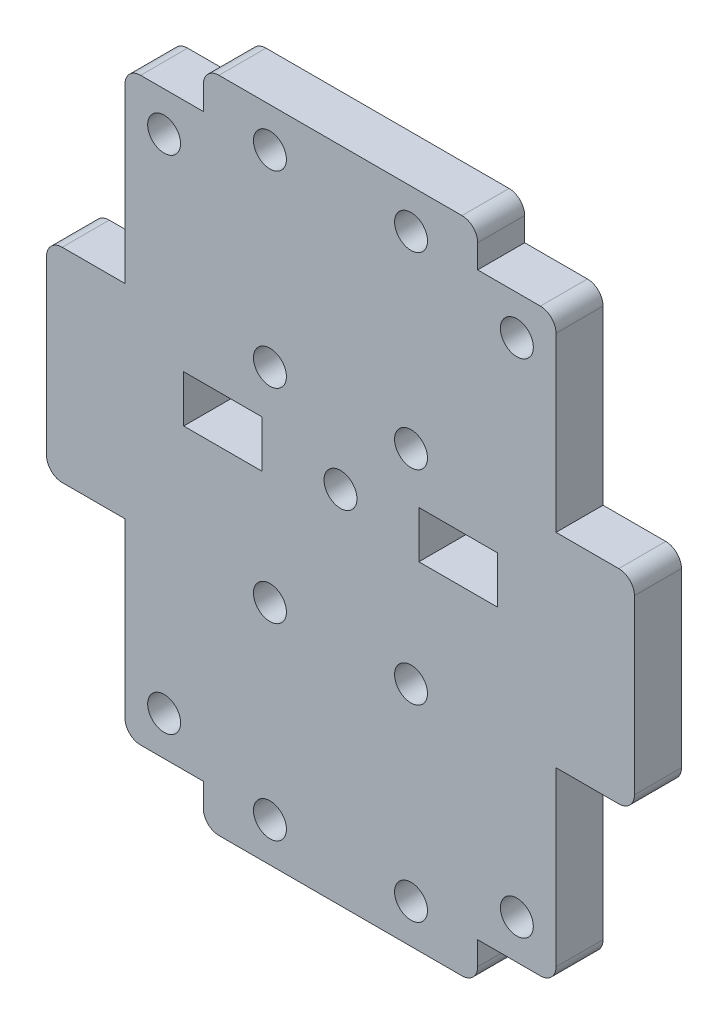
SolidWorks part; units mm, degrees
ref_plane "Спереди" through (0, 0, 0) normal (0, 0, 1) x (1, 0, 0)
ref_plane "Сверху" through (0, 0, 0) normal (0, 1, 0) x (1, 0, 0)
ref_plane "Справа" through (0, 0, 0) normal (1, 0, 0) x (0, 0, -1)
sketch "Эскиз1" plane through (0, 0, 0) normal (0, 0, 1) x (1, 0, 0)
  line L0 (0, 42) -> (17.5, 42) construction
  line L1 (2, 0) -> (33, 0)
  line L2 (0, 2) -> (0, 82)
  line L3 (2, 84) -> (33, 84)
  line L4 (35, 2) -> (35, 82)
  line L5 (8.5, 29) -> (26.5, 29) construction
  line L6 (8.5, 29) -> (8.5, 5) construction
  line L7 (8.5, 5) -> (26.5, 5) construction
  line L8 (26.5, 29) -> (26.5, 5) construction
  line L9 (26.5, 55) -> (26.5, 79) construction
  line L10 (8.5, 79) -> (26.5, 79) construction
  line L11 (8.5, 55) -> (8.5, 79) construction
  line L12 (8.5, 55) -> (26.5, 55) construction
  line L13 (17.5, 84) -> (17.5, 80.8453) construction
  line L14 (-2.5, 49) -> (7.5, 49)
  line L15 (-2.5, 49) -> (-2.5, 43)
  line L16 (-2.5, 43) -> (7.5, 43)
  line L17 (7.5, 49) -> (7.5, 43)
  line L18 (27.5, 49) -> (37.5, 49)
  line L19 (27.5, 49) -> (27.5, 43)
  line L20 (27.5, 43) -> (37.5, 43)
  line L21 (37.5, 49) -> (37.5, 43)
  line L22 (0, 55) -> (-18, 55)
  line L23 (0, 55) -> (0, 29)
  line L24 (0, 29) -> (-18, 29)
  line L25 (-20, 53) -> (-20, 31)
  line L26 (35, 55) -> (53, 55)
  line L27 (35, 29) -> (53, 29)
  line L28 (55, 53) -> (55, 31)
  circle A0 centre (8.5, 29) radius 2.1
  circle A1 centre (26.5, 29) radius 2.1
  circle A2 centre (26.5, 5) radius 2.1
  circle A3 centre (8.5, 5) radius 2.1
  circle A4 centre (8.5, 79) radius 2.1
  circle A5 centre (26.5, 79) radius 2.1
  circle A6 centre (26.5, 55) radius 2.1
  circle A7 centre (8.5, 55) radius 2.1
  circle A8 centre (17.5, 46) radius 2.1
  arc A9 (-18, 29) -> (-20, 31) centre (-18, 31) cw
  arc A10 (-18, 55) -> (-20, 53) centre (-18, 53) ccw
  arc A11 (53, 55) -> (55, 53) centre (53, 53) cw
  arc A12 (53, 29) -> (55, 31) centre (53, 31) ccw
  arc A13 (2, 0) -> (0, 2) centre (2, 2) cw
  arc A14 (33, 0) -> (35, 2) centre (33, 2) ccw
  arc A15 (33, 84) -> (35, 82) centre (33, 82) cw
  arc A16 (0, 82) -> (2, 84) centre (2, 82) cw
  point P13 (17.5, 0)
  point P14 (17.5, 5)
  point P25 (17.5, 79)
  point P26 (8.5, 67)
  point P27 (8.5, 17)
  point P38 (7.5, 46)
  point P39 (27.5, 46)
  point P50 (-20, 55)
  point P59 (55, 55)
  point P62 (0, 0)
  point P65 (35, 0)
extrude "Бобышка-Вытянуть1" add sketch "Эскиз1" along normal blind 6 contours L22 A10 L25 A9 L24 L2 L16 L15 L14 | A16 L2 L14 L17 L16 A13 L1 A14 L4 L20 L19 L18 A15 L3 A8 A6 A4 A3 A2 A1 A0 A5 A7 | L27 A12 L28 A11 L26 L4 L18 L21 L20
sketch "Эскиз2" plane through (0, 0, 6) normal (0, 0, 1) x (1, 0, 0)
  line L0 (0, 55) -> (0, 82) construction
  line L1 (0, 79) -> (-8, 79)
  line L2 (0, 79) -> (0, 53)
  line L3 (0, 53) -> (-8, 53)
  line L4 (-10, 77) -> (-10, 55)
  line L5 (2, 84) -> (33, 84) construction
  line L6 (17.5, 84) -> (17.5, 88.9599) construction
  line L7 (-20, 42) -> (-32.8086, 42) construction
  line L8 (-20, 53) -> (-20, 31) construction
  line L9 (45, 77) -> (45, 55)
  line L10 (35, 53) -> (43, 53)
  line L11 (35, 79) -> (35, 53)
  line L12 (35, 79) -> (43, 79)
  line L13 (17.5, 0) -> (17.5, -4.9599) construction
  line L14 (35, 5) -> (43, 5)
  line L15 (35, 5) -> (35, 31)
  line L16 (35, 31) -> (43, 31)
  line L17 (45, 7) -> (45, 29)
  line L18 (-10, 7) -> (-10, 29)
  line L19 (0, 31) -> (-8, 31)
  line L20 (0, 5) -> (0, 31)
  line L21 (0, 5) -> (-8, 5)
  arc A0 (-8, 53) -> (-10, 55) centre (-8, 55) cw
  arc A1 (-8, 79) -> (-10, 77) centre (-8, 77) ccw
  arc A2 (43, 79) -> (45, 77) centre (43, 77) cw
  arc A3 (43, 53) -> (45, 55) centre (43, 55) ccw
  arc A4 (43, 31) -> (45, 29) centre (43, 29) cw
  arc A5 (43, 5) -> (45, 7) centre (43, 7) ccw
  arc A6 (-8, 5) -> (-10, 7) centre (-8, 7) cw
  arc A7 (-8, 31) -> (-10, 29) centre (-8, 29) ccw
  point P10 (-10, 53)
  point P13 (-10, 79)
  point P28 (45, 79)
  point P29 (45, 53)
  point P48 (45, 31)
  point P49 (45, 5)
  point P50 (-10, 5)
  point P51 (-10, 31)
  dimension "D4" = 2
  dimension "D1" = 10
  dimension "D2" = 22
  dimension "D3" = 5
extrude "Бобышка-Вытянуть2" add sketch "Эскиз2" against normal up to surface (6 mm away)
sketch "Эскиз3" plane through (0, 0, 6) normal (0, 0, 1) x (1, 0, 0)
  line L0 (-10, 77) -> (-10, 55) construction
  line L1 (0, 79) -> (-8, 79) construction
  line L2 (45, 7) -> (45, 29) construction
  line L3 (35, 5) -> (43, 5) construction
  circle A0 centre (-5, 74) radius 2.1
  circle A1 centre (40, 74) radius 2.1
  circle A2 centre (-5, 10) radius 2.1
  circle A3 centre (40, 10) radius 2.1
  dimension "D1" = 4.2
  dimension "D2" = 5
  dimension "D3" = 5
  dimension "D4" = 5
  dimension "D5" = 5
extrude "Вырез-Вытянуть1" cut sketch "Эскиз3" against normal through all
equation "\"D12@Эскиз1\"=\"D11@Эскиз1\"/2"
